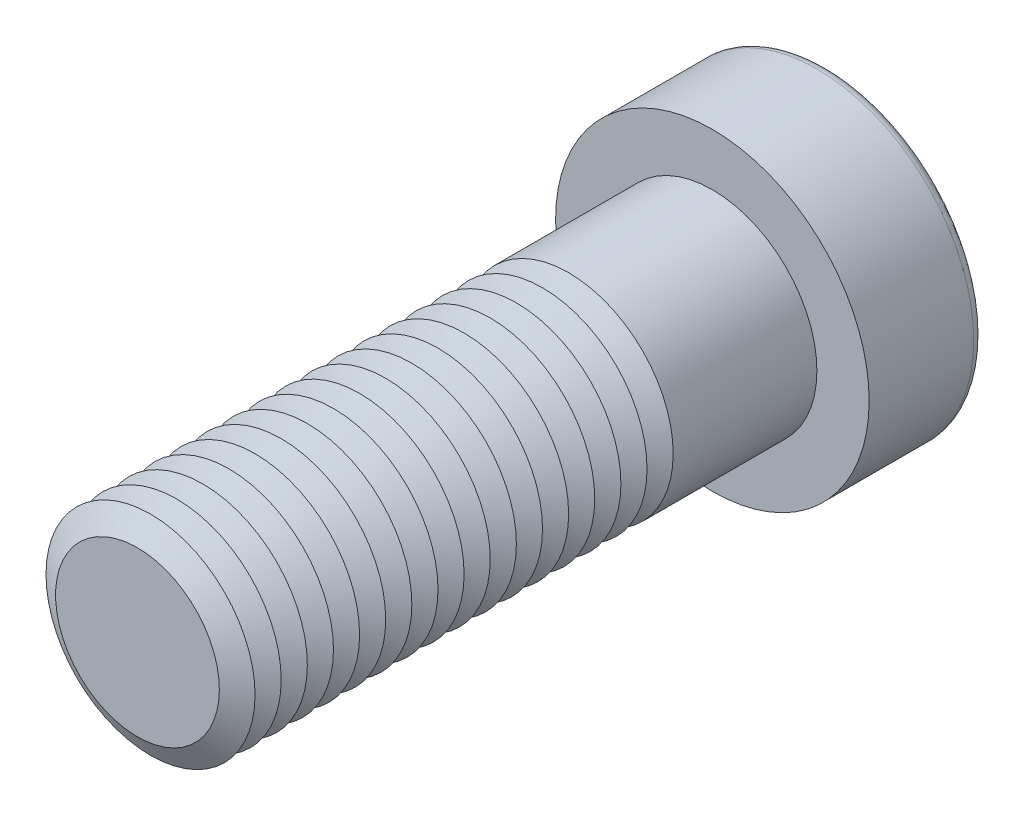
SolidWorks part; units mm, degrees
ref_plane "Front Plane" through (0, 0, 0) normal (0, 0, 1) x (1, 0, 0)
ref_plane "Top Plane" through (0, 0, 0) normal (0, 1, 0) x (1, 0, 0)
ref_plane "Right Plane" through (0, 0, 0) normal (1, 0, 0) x (0, 0, -1)
sketch "Sketch1" plane through (0, 0, 0) normal (0, 0, 1) x (1, 0, 0)
  circle A0 centre (0, 0) radius 10
  dimension "D1" = 20
extrude "Boss-Extrude1" add sketch "Sketch1" along normal blind 55
sketch "Sketch2" plane through (0, 0, 0) normal (0, 0, -1) x (-1, 0, 0)
  circle A0 centre (0, 0) radius 15
  dimension "D1" = 30
extrude "Boss-Extrude2" add sketch "Sketch2" along normal blind 11
sketch "Sketch3" plane through (0, 0, -11) normal (0, 0, -1) x (-1, 0, 0)
  line L1 (-4.0415, 7) -> (-8.0829, 0)
  line L2 (-8.0829, 0) -> (-4.0415, -7)
  line L3 (-4.0415, -7) -> (4.0415, -7)
  line L4 (4.0415, -7) -> (8.0829, 0)
  line L5 (8.0829, 0) -> (4.0415, 7)
  line L6 (4.0415, 7) -> (-4.0415, 7)
  circle A0 centre (0, 0) radius 7 construction
  dimension "D1" = 14
extrude "Cut-Extrude1" cut sketch "Sketch3" against normal blind 10.5
fillet "Fillet1" radius 1 1 edges at (-15, 0, -11)
sketch "Sketch4" plane through (0, 0, -0.5) normal (0, 0, -1) x (-1, 0, 0)
  line L0 (4.0415, -7) -> (8.0829, 0) construction
  circle A0 centre (0, 0) radius 7
extrude "Cut-Extrude2" cut sketch "Sketch4" against normal through all draft 60
sketch "Sketch5" plane through (0, 0, -11) normal (0, 0, -1) x (-1, 0, 0)
  circle A0 centre (0, 0) radius 8.0829
extrude "Cut-Extrude3" cut sketch "Sketch5" against normal through all draft 75
sketch "Sketch7" plane through (0, 0, 0) normal (1, 0, 0) x (0, 0, -1)
  line L25 (-55, 7.8349) -> (-53.75, 10)
  line L26 (-55, 10) -> (-55, -10) construction
  line L27 (-53.75, 10) -> (-56.25, 10)
  line L28 (-56.25, 10) -> (-55, 7.8349)
  line L29 (0, 10) -> (-55, 10) construction
  dimension "D1" = 2.5
revolve "Cut-Revolve1" cut sketch "Sketch7" angle 360 about axis through (0, 0, 55) along (0, 0, -1)
pattern_linear "LPattern1" count 17 spacing 2.5 along (0, 0, -1) of "Cut-Revolve1"
